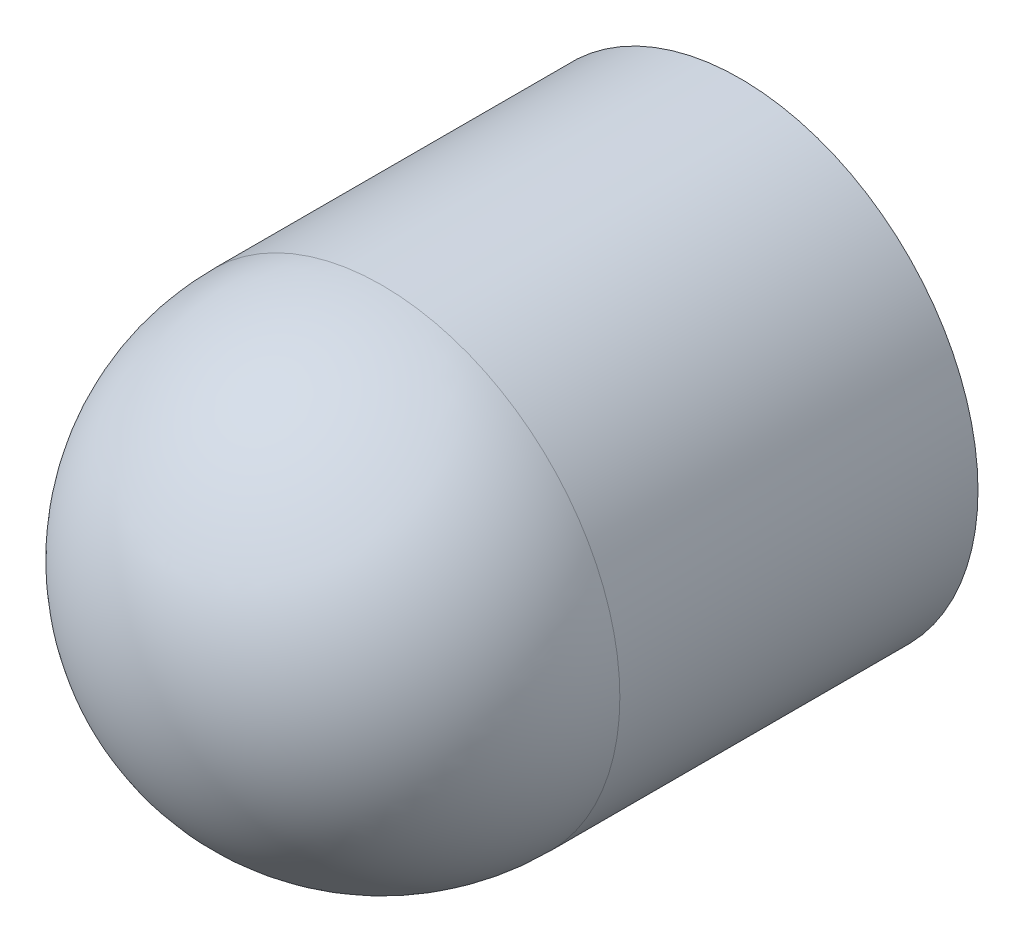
SolidWorks part; units mm, degrees
ref_plane "Спереди" through (0, 0, 0) normal (0, 0, 1) x (1, 0, 0)
ref_plane "Сверху" through (0, 0, 0) normal (0, 1, 0) x (1, 0, 0)
ref_plane "Справа" through (0, 0, 0) normal (1, 0, 0) x (0, 0, -1)
sketch "Эскиз1" plane through (0, 0, 0) normal (1, 0, 0) x (0, 0, -1)
  line L0 (0, 0) -> (10.2117, 0) construction
  line L1 (0, 0) -> (7.9248, 0)
  line L2 (7.9248, 0) -> (7.9248, 3.1623)
  line L3 (7.9248, 3.1623) -> (3.1623, 3.1623)
  arc A0 (0, 0) -> (3.1623, 3.1623) centre (3.1623, 0) cw
  dimension "D1" = 7.9248
  dimension "D2" = 6.3246
revolve "Повернуть1" add sketch "Эскиз1" angle 360 about L0
